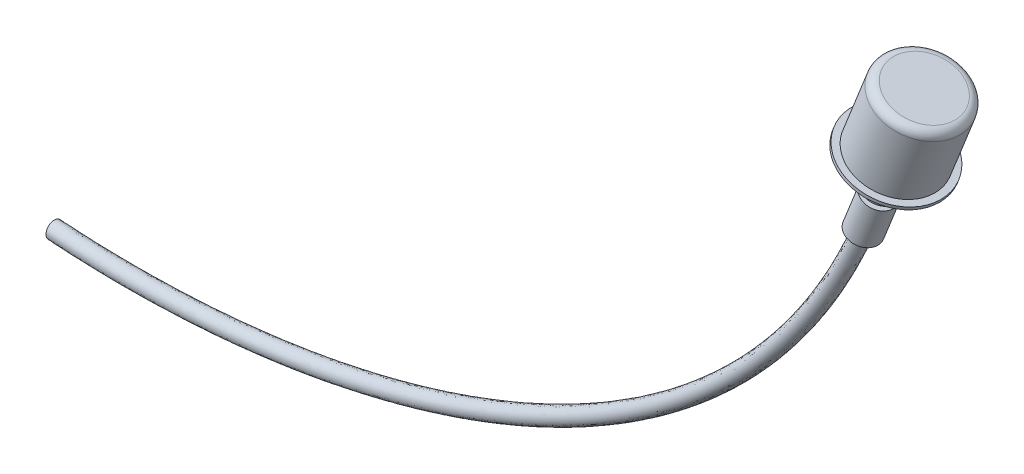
SolidWorks part; units mm, degrees
ref_plane "Plan de face" through (0, 0, 0) normal (0, 0, 1) x (1, 0, 0)
ref_plane "Plan de dessus" through (0, 0, 0) normal (0, 1, 0) x (1, 0, 0)
ref_plane "Plan de droite" through (0, 0, 0) normal (1, 0, 0) x (0, 0, -1)
sketch "Esquisse2" plane through (0, 0, 0) normal (1, 0, 0) x (0, 0, -1)
  circle A0 centre (0, 0) radius 5
  dimension "D1" = 10
sketch "Esquisse4" plane through (0, 0, 0) normal (0, 0, 1) x (1, 0, 0)
  spline S0 degree 3 poles (0, 0) (190.4985, -13.4125) (414.6445, 55.1206) (492.8712, 252.0037) knots 0 0 0 0 1 1 1 1
ref_plane "Plan3" through (492.8712, 252.0037, 0) normal (0.3692, 0.9293, 0) x (-0.9293, 0.3692, 0)
sketch "Esquisse5" plane through (492.8712, 252.0037, 0) normal (0.3692, 0.9293, 0) x (-0.9293, 0.3692, 0)
  line L0 (364.989, 0) -> (0, 0) construction
  circle A0 centre (0, 0) radius 5
  dimension "D1" = 10
sweep "Balayage1" add profiles "Esquisse2" path "Esquisse4"
sketch "Esquisse6" plane through (0, 0, 0) normal (0, 0, 1) x (1, 0, 0)
  line L0 (492.8712, 252.0037) -> (544.8612, 382.8536) construction
  line L1 (497.5178, 250.1574) -> (488.2245, 253.8499) construction
  line L2 (485.2063, 246.4408) -> (481.1502, 248.0524)
  line L3 (481.1502, 248.0524) -> (490.7005, 272.089)
  line L4 (490.7005, 272.089) -> (493.5563, 270.9543)
  line L5 (493.5563, 270.9543) -> (495.1084, 274.8607)
  line L6 (495.1084, 274.8607) -> (491.5435, 276.2771)
  line L7 (491.5435, 276.2771) -> (497.4955, 291.2574)
  line L8 (497.4955, 291.2574) -> (488.6038, 301.3335)
  line L9 (488.6038, 301.3335) -> (482.2313, 303.8655)
  line L10 (482.2313, 303.8655) -> (482.9698, 305.7241)
  line L11 (482.9698, 305.7241) -> (486.7222, 304.2332)
  line L12 (486.7222, 304.2332) -> (503.6086, 346.7333)
  line L13 (503.6086, 346.7333) -> (526.8419, 337.5021)
  line L14 (526.8419, 337.5021) -> (489.9172, 244.569)
  line L15 (489.9172, 244.569) -> (485.2063, 246.4408)
  spline S0 degree 3 poles (488.1063, 253.519) (476.793, 225.0393) (447.8887, 173.6017) (389.4077, 111.8677) (312.5157, 60.3574) (217.5641, 22.9372) (108.2091, 3.1623) (35.2881, 2.4839) (0, 5) knots 0 0 0 0 0.146667 0.293333 0.44 0.626667 0.813333 1 1 1 1 weights 0.5 0.5 0.5 0.5 0.5 0.5 0.5 0.5 0.5 construction
  dimension "D1" = 100
  dimension "D2" = 8
  dimension "D3" = 2
  dimension "D4" = 50
revolve "Révolution1" add sketch "Esquisse6" angle 360 about L0
fillet "Congé1" radius 5 1 edges at (550.0752, 328.271, 0)
sketch "Esquisse7" plane through (0, 0, 108.734) normal (0, 0, 1) x (1, 0, 0)
  line L0 (272.979, 106.0816) -> (364.2499, -58.4981)
  line L1 (364.2499, -58.4981) -> (-199.5586, -43.7328)
  line L2 (-199.5586, -43.7328) -> (-183.0137, 87.2754)
  line L3 (-183.0137, 87.2754) -> (272.979, 106.0816)
